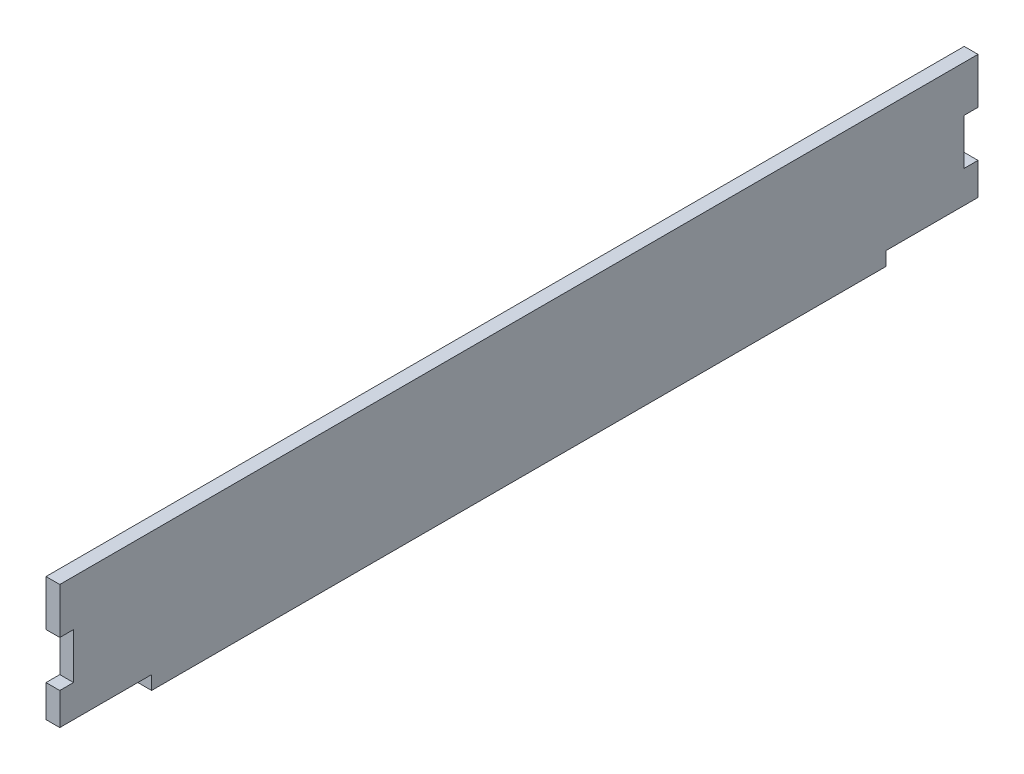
SolidWorks part; units mm, degrees
ref_plane "Front Plane" through (0, 0, 0) normal (0, 0, 1) x (1, 0, 0)
ref_plane "Top Plane" through (0, 0, 0) normal (0, 1, 0) x (1, 0, 0)
ref_plane "Right Plane" through (0, 0, 0) normal (1, 0, 0) x (0, 0, -1)
sketch "Sketch1" plane through (0, 0, 0) normal (1, 0, 0) x (0, 0, -1)
  line L0 (75.8905, 14.4036) -> (-124.1095, 14.4036)
  line L1 (75.8905, 14.4036) -> (75.8905, 4.4036)
  line L2 (-124.1095, 14.4036) -> (-124.1095, 4.4036)
  line L3 (-104.1095, -15.5964) -> (55.8905, -15.5964)
  line L4 (75.8905, -5.5964) -> (75.8905, -12.5964)
  line L5 (72.8905, 4.4036) -> (72.8905, -5.5964)
  line L6 (-104.1095, -15.5964) -> (-104.1095, -12.5964)
  line L7 (72.8905, 4.4036) -> (75.8905, 4.4036)
  line L8 (72.8905, -5.5964) -> (75.8905, -5.5964)
  line L9 (-124.1095, 4.4036) -> (-121.1095, 4.4036)
  line L10 (-124.1095, -5.5964) -> (-121.1095, -5.5964)
  line L11 (-121.1095, 4.4036) -> (-121.1095, -5.5964)
  line L12 (-124.1095, -5.5964) -> (-124.1095, -12.5964)
  line L13 (75.8905, -12.5964) -> (55.8905, -12.5964)
  line L14 (-104.1095, -12.5964) -> (-124.1095, -12.5964)
  line L16 (55.8905, -15.5964) -> (55.8905, -12.5964)
extrude "Boss-Extrude1" add sketch "Sketch1" along normal blind 3
ref_plane "Plane1" through (0, 14.4036, -75.8905) normal (0, 0, 1) x (1, 0, 0)
